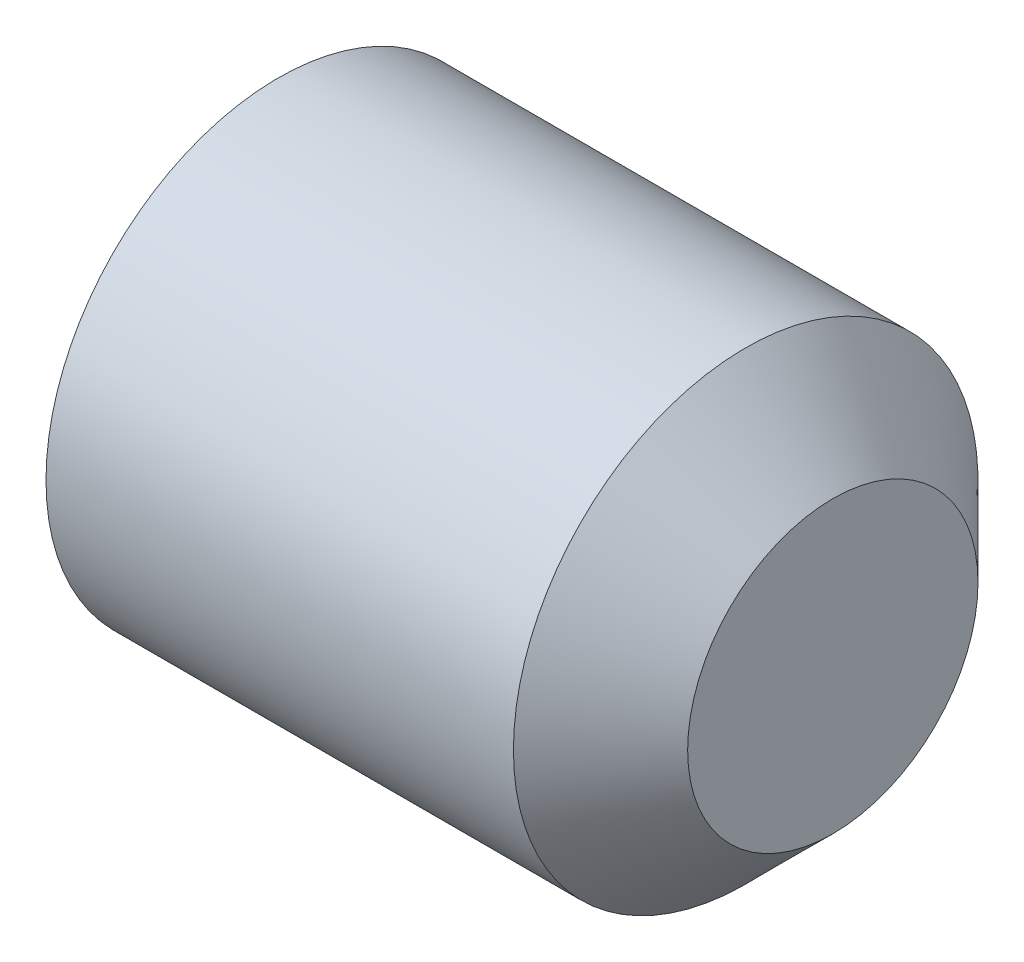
SolidWorks part; units mm, degrees
ref_plane "Plane1" through (0, 0, 0) normal (0, 0, 1) x (1, 0, 0)
ref_plane "Plane2" through (0, 0, 0) normal (0, 1, 0) x (1, 0, 0)
ref_plane "Plane3" through (0, 0, 0) normal (1, 0, 0) x (0, 0, -1)
revolve "BaseBody" add sketch "BodySke" angle 360 about L5
sketch "BodySke" plane through (0, 0, 0) normal (0, 0, 1) x (1, 0, 0)
  line L0 (0, 0) -> (0, 1.61)
  line L1 (0, 1.61) -> (0.2252, 2)
  line L2 (0.2252, 2) -> (4.25, 2)
  line L3 (4.25, 2) -> (5, 1.25)
  line L4 (5, 0) -> (0, 0)
  line L5 (-12.7, 0) -> (88.9, 0) construction
  line L6 (5, 1.25) -> (5, 0)
  line L7 (5, 1.25) -> (5, 10.775) construction
  line L8 (0, -1.61) -> (0.2252, -2) construction
  line L9 (0.7, 15.875) -> (0.7, -3.175) construction
  line L10 (4.25, -2) -> (5, -1.25) construction
  dimension "Length" = 5
  dimension "Diameter" = 4
  dimension "Drive_ch_ang" = 60
  dimension "Minor_dia" = 3.22
  dimension "Cup_nose_ang" = 45
  dimension "Cup_dia" = 2.5
  dimension "Advance" = 0.7
sketch "Sketch2" plane through (0, 0, 0) normal (-1, 0, 0) x (0, 0, 1)
  line L0 (0.5774, 1) -> (-0.5774, 1)
  line L1 (-0.5774, 1) -> (-1.1547, 0)
  line L2 (0.5774, 1) -> (1.1547, 0)
  line L3 (0.5774, -1) -> (1.1547, 0)
  line L4 (0.5774, -1) -> (-0.5774, -1)
  line L5 (-0.5774, -1) -> (-1.1547, 0)
  dimension "Hex_size" = 2
  dimension "D2" = 1
  dimension "D3" = 1
extrude "Hex" cut sketch "Sketch2" against normal blind 2.3
sketch "Sketch4" plane through (0, 4.7709, -0.5249) normal (-1, 0, 0) x (0, 0, 1)
  line L0 (0.5249, -4.7709) -> (1.7694, -4.7709)
  line L1 (0.5249, -4.7709) -> (6.6732, -1.2211) construction
  line L2 (0.5249, -4.7709) -> (1.1471, -3.6931)
  line L3 (1.5335, -4.5113) -> (1.7149, -4.4066)
  line L4 (1.254, -4.0272) -> (1.4354, -3.9225)
  arc A0 (1.5335, -4.5113) -> (1.254, -4.0272) centre (0.5249, -4.7709) ccw
  arc A1 (1.7694, -4.7709) -> (1.7149, -4.4066) centre (0.5249, -4.7709) ccw
  arc A2 (1.1471, -3.6931) -> (1.4354, -3.9225) centre (0.5249, -4.7709) cw
  circle A3 centre (0.5249, -4.7709) radius 1.0415 construction
  circle A4 centre (0.5249, -4.7709) radius 1.2445 construction
  dimension "D1" = 30
  dimension "Spline_n_dim" = 2.083
  dimension "Spline_m_dim" = 2.489
  dimension "Spline_a_dim" = 60
  dimension "D3" = 0.2795
  dimension "Spline_p_dim" = 0.559
extrude "Spline6" cut sketch "Sketch4" against normal blind 2
pattern_circular "CirPattern1" count 6 every 60 about axis through (-12.7, 0, 0) along (1, 0, 0)
sketch "Sketch5" plane through (0, 0.6556, 6.6316) normal (-1, 0, 0) x (0, 0, 1)
  line L0 (-6.6316, -0.6556) -> (-5.3871, -0.6556)
  line L1 (-6.6316, -0.6556) -> (-1.6115, 4.3645) construction
  line L2 (-6.6316, -0.6556) -> (-6.6316, 0.5889)
  line L3 (-5.6975, -0.1168) -> (-5.5765, 0.0043)
  line L4 (-6.0928, 0.2785) -> (-5.9717, 0.3996)
  line L5 (-6.0928, 0.2785) -> (-5.6975, -0.1168)
  arc A1 (-5.3871, -0.6556) -> (-5.5765, 0.0043) centre (-6.6316, -0.6556) ccw
  arc A2 (-6.6316, 0.5889) -> (-5.9717, 0.3996) centre (-6.6316, -0.6556) cw
  circle A3 centre (-6.6316, -0.6556) radius 1.0415 construction
  circle A4 centre (-6.6316, -0.6556) radius 1.2445 construction
  dimension "D1" = 45
  dimension "Spline_n_dim" = 2.083
  dimension "Spline_m_dim" = 2.489
  dimension "Spline_a_dim" = 90
  dimension "D3" = 0.2795
  dimension "Spline_p_dim" = 0.559
extrude "Spline4" cut sketch "Sketch5" against normal blind 2
pattern_circular "CirPattern2" count 4 every 90 about axis through (-12.7, 0, 0) along (1, 0, 0)
sketch "ThdSchSke" plane through (0, 0, 0) normal (0, 0, 1) x (1, 0, 0)
  line L0 (0.2252, -1.61) -> (-0.0479, -2)
  line L1 (0.2252, -1.61) -> (0.4982, -2)
  line L2 (0.4982, -2) -> (0.4982, -2.5)
  line L3 (-3.175, 0) -> (5.1513, 0) construction
  line L4 (0.2252, 2) -> (0.2252, -2) construction
  line L5 (0.4982, -2.5) -> (-0.0479, -2.5)
  line L6 (-0.0479, -2.5) -> (-0.0479, -2)
  dimension "Thread_minor" = 3.22
  dimension "Diameter" = 4
  dimension "SideAngle" = 55
  dimension "VeeAngle" = 70
  dimension "Overcut" = 5
revolve "ThreadSchematic" cut sketch "ThdSchSke" angle 360 about L3
pattern_linear "ThdSchPat"
equation "\"D2@Sketch2\" = \"Hex_size@Sketch2\" / 2"
equation "\"D3@Sketch2\" = \"Hex_size@Sketch2\" / 2"
equation "\"Thread_minor@ThreadCosmetic\" = \"Minor_dia@BodySke\""
equation "\"D1@Sketch4\" = \"Spline_a_dim@Sketch4\" / 2"
equation "\"D3@Sketch4\" = \"Spline_p_dim@Sketch4\" / 2"
equation "\"D2@CirPattern1\" = \"Spline_a_dim@Sketch4\""
equation "\"Num_teeth@CirPattern1\" = 360 / \"D2@CirPattern1\""
equation "\"Spline_a_dim@Sketch5\" = 90"
equation "\"Spline_p_dim@Sketch5\" = \"Spline_p_dim@Sketch4\""
equation "\"Spline_m_dim@Sketch5\" = \"Spline_m_dim@Sketch4\""
equation "\"Spline_n_dim@Sketch5\" = \"Spline_n_dim@Sketch4\""
equation "\"D1@Sketch5\" = \"Spline_a_dim@Sketch5\" / 2"
equation "\"D3@Sketch5\" = \"Spline_p_dim@Sketch5\" / 2"
equation "\"Key_eng@Spline4\" = \"Key_eng@Spline6\""
equation "\"Thread_minor@ThdSchSke\" = \"Thread_minor@ThreadCosmetic\""
equation "\"Diameter@ThdSchSke\" = \"Diameter@BodySke\""
equation "\"Overcut@ThdSchSke\" = \"Diameter@BodySke\" * 1.25"
equation "\"Num_threads@ThdSchPat\" = int( (\"Length@BodySke\" - ( ( ( \"Diameter@BodySke\" - \"Minor_dia@BodySke\" ) * 0.5 ) / tan( \"Drive_ch_ang@BodySke\" * 0.017453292 ) ) - ( ( ( \"Diameter@BodySke\" - \"Cup_dia@BodySk"
equation "\"Advance@ThdSchPat\" = (\"Length@BodySke\" - ( ( ( \"Diameter@BodySke\" - \"Minor_dia@BodySke\" ) * 0.5 ) / tan( \"Drive_ch_ang@BodySke\" * 0.017453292 ) ) - ( ( ( \"Diameter@BodySke\" - \"Cup_dia@BodySke\" ) * 0."
equation "' \"Num_threads@ThdSchPat\" = \"Num_threads@ThdSchPat\" - sgn( \"Num_threads@ThdSchPat\" - 1) '---chamfered tips only---"
